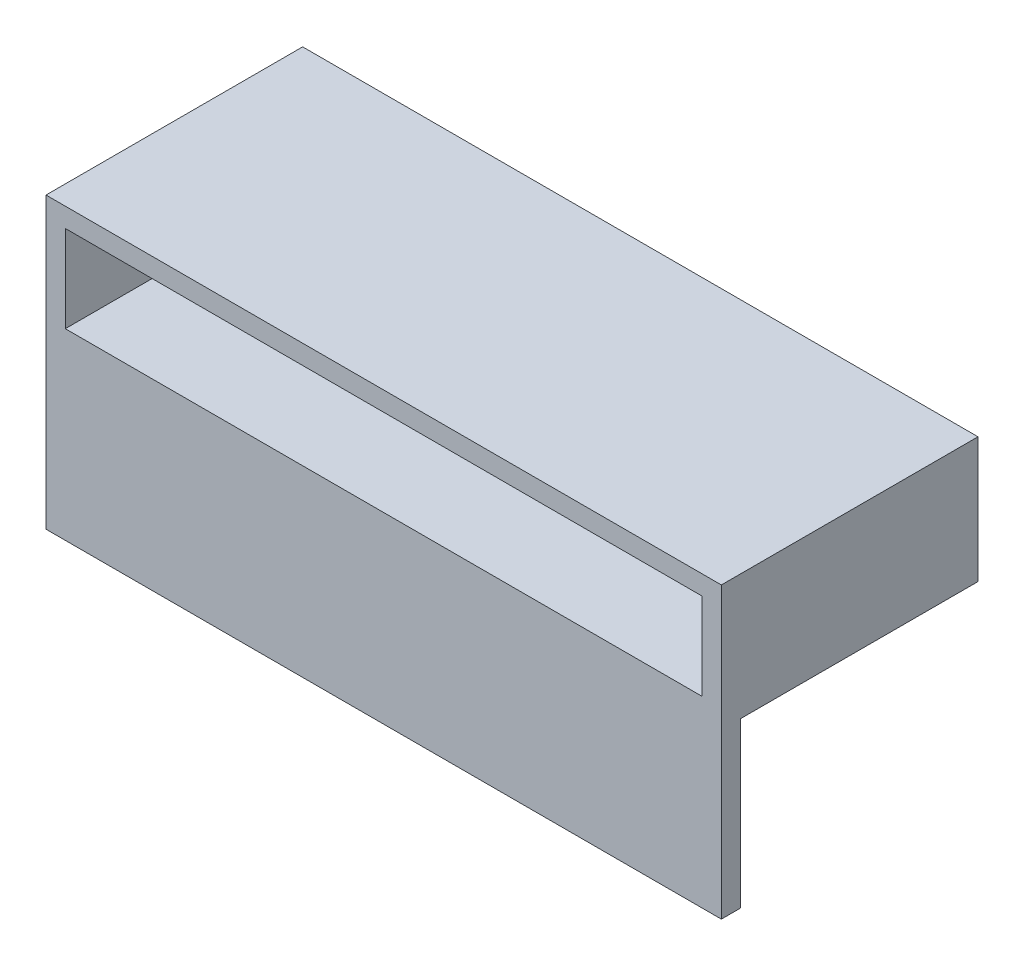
SolidWorks part; units mm, degrees
ref_plane "Плоскость1" through (0, 0, 0) normal (0, 0, 1) x (1, 0, 0)
ref_plane "Плоскость2" through (0, 0, 0) normal (0, 1, 0) x (1, 0, 0)
ref_plane "Плоскость3" through (0, 0, 0) normal (1, 0, 0) x (0, 0, -1)
sketch "Эскиз1" plane through (0, 0, 0) normal (0, 0, 1) x (1, 0, 0)
  line L1 (-35, 0) -> (35, 0)
  line L2 (-35, 0) -> (-35, 30)
  line L3 (-35, 30) -> (35, 30)
  line L4 (35, 0) -> (35, 30)
  dimension "D1" = 70
  dimension "D2" = 30
extrude "Основание-Вытянуть" add sketch "Эскиз1" along normal blind 2
sketch "Эскиз2" plane through (0, 0, 0) normal (0, 0, -1) x (-1, 0, 0)
  line L0 (35, 30) -> (35, 0) construction
  line L1 (-35, 30) -> (35, 30)
  line L2 (-35, 30) -> (-35, 17)
  line L3 (-35, 17) -> (35, 17)
  line L4 (35, 30) -> (35, 17)
  dimension "D1" = 13
extrude "Бобышка-Вытянуть1" add sketch "Эскиз2" along normal blind 24.6
sketch "Эскиз3" plane through (0, 0, 2) normal (0, 0, 1) x (1, 0, 0)
  line L0 (35, 30) -> (-35, 30) construction
  line L1 (-33, 19) -> (33, 19)
  line L2 (-33, 19) -> (-33, 28)
  line L3 (-33, 28) -> (33, 28)
  line L4 (33, 19) -> (33, 28)
  line L5 (35, 0) -> (35, 30) construction
  line L6 (-35, 30) -> (-35, 0) construction
  dimension "D1" = 2
  dimension "D2" = 9
  dimension "D3" = 2
  dimension "D4" = 2
extrude "Вырез-Вытянуть1" cut sketch "Эскиз3" against normal blind 24.6
